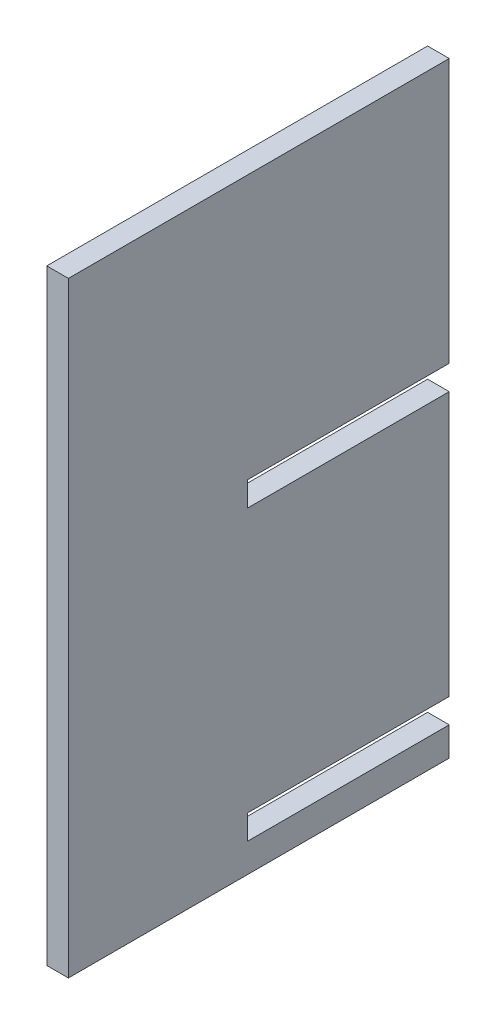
SolidWorks part; units mm, degrees
ref_plane "Alzado" through (0, 0, 0) normal (0, 0, 1) x (1, 0, 0)
ref_plane "Planta" through (0, 0, 0) normal (0, 1, 0) x (1, 0, 0)
ref_plane "Vista lateral" through (0, 0, 0) normal (1, 0, 0) x (0, 0, -1)
sketch "Croquis16" plane through (0, 0, 0) normal (0, 0, 1) x (1, 0, 0)
  line L0 (-18.25, -39.75) -> (-16.75, -39.75)
  line L1 (-18.5, -40) -> (-16.5, -40) construction
  line L2 (-18.5, -40) -> (-18.5, 40) construction
  line L3 (-18.5, 40) -> (-16.5, 40) construction
  line L4 (-16.5, -40) -> (-16.5, 40) construction
  line L5 (-16.75, -39.75) -> (-16.75, 39.75)
  line L6 (-18.25, 39.75) -> (-16.75, 39.75)
  line L7 (-18.25, -39.75) -> (-18.25, 39.75)
  dimension "D1" = 0.25
extrude "Saliente-Extruir9" add sketch "Croquis16" along normal blind 26.4
sketch "Croquis20" plane through (-16.75, 0, 0) normal (1, 0, 0) x (0, 0, -1)
  line L1 (0, -20.85) -> (-14, -20.85)
  line L2 (0, -20.85) -> (0, -19.15)
  line L3 (0, -19.15) -> (-14, -19.15)
  line L4 (-14, -20.85) -> (-14, -19.15)
  line L10 (0, -0.85) -> (-14, -0.85)
  line L11 (0, -0.85) -> (0, 0.85)
  line L12 (0, 0.85) -> (-14, 0.85)
  line L13 (-14, -0.85) -> (-14, 0.85)
  line L14 (0, 19.15) -> (-14, 19.15)
  line L15 (0, 19.15) -> (0, 20.85)
  line L16 (0, 20.85) -> (-14, 20.85)
  line L17 (-14, 19.15) -> (-14, 20.85)
  line L22 (0, -39.75) -> (0, 39.75) construction
  dimension "D1" = 1.7
  dimension "D2" = 14
  dimension "D4" = 1.7
  dimension "D5" = 1.7
  dimension "D6" = 14
  dimension "D7" = 14
extrude "Cortar-Extruir2" cut sketch "Croquis20" against normal up to surface (1.5 mm away)
sketch "Croquis21" plane through (-16.75, 0, 0) normal (1, 0, 0) x (0, 0, -1)
  line L1 (0, -22.85) -> (-26.4, -22.85)
  line L2 (0, -22.85) -> (0, -39.75)
  line L3 (0, -39.75) -> (-26.4, -39.75)
  line L4 (-26.4, -22.85) -> (-26.4, -39.75)
  line L5 (-14, -20.85) -> (0, -20.85) construction
  line L7 (0, 39.75) -> (-26.4, 39.75)
  line L8 (0, 39.75) -> (0, 19.15)
  line L9 (0, 19.15) -> (-26.4, 19.15)
  line L10 (-26.4, 39.75) -> (-26.4, 19.15)
  dimension "D1" = 2
extrude "Cortar-Extruir3" cut sketch "Croquis21" against normal up to surface (1.5 mm away)
